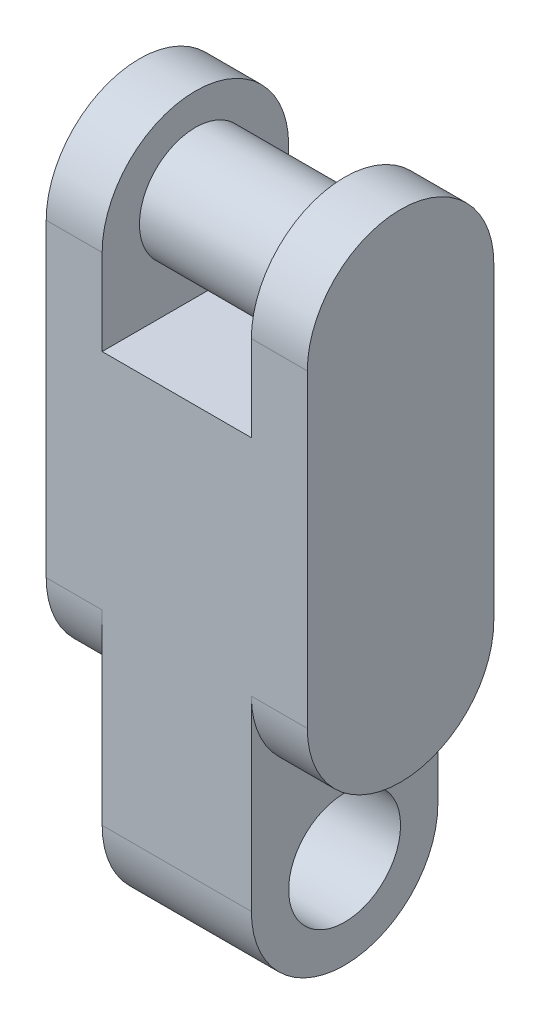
SolidWorks part; units mm, degrees
ref_plane "Front Plane" through (0, 0, 0) normal (0, 0, 1) x (1, 0, 0)
ref_plane "Top Plane" through (0, 0, 0) normal (0, 1, 0) x (1, 0, 0)
ref_plane "Right Plane" through (0, 0, 0) normal (1, 0, 0) x (0, 0, -1)
sketch "Sketch1" plane through (0, 0, 0) normal (0, 0, 1) x (1, 0, 0)
  line L1 (-58.945, 37.0453) -> (-58.945, 10.4453)
  line L2 (-58.945, 10.4453) -> (-55.945, 10.4453)
  line L3 (-44.945, 10.4453) -> (-44.945, 37.0453)
  line L5 (-47.945, 10.4453) -> (-47.945, 0.4453)
  line L6 (-55.945, 37.0453) -> (-55.945, 27.4465)
  line L7 (-55.945, 27.4465) -> (-47.945, 27.4465)
  line L8 (-47.945, 27.4465) -> (-47.945, 37.0453)
  line L9 (-58.945, 37.0453) -> (-55.945, 37.0453)
  line L10 (-47.945, 37.0453) -> (-44.945, 37.0453)
  line L11 (-47.945, 0.4453) -> (-55.945, 0.4453)
  line L12 (-55.945, 0.4453) -> (-55.945, 10.4453)
  line L13 (-47.945, 10.4453) -> (-44.945, 10.4453)
extrude "Boss-Extrude1" add sketch "Sketch1" along normal blind 10
sketch "Sketch2" plane through (-47.945, 0, 0) normal (-1, 0, 0) x (0, 0, 1)
  circle A0 centre (5, 32.354) radius 3
extrude "Boss-Extrude2" add sketch "Sketch2" along normal blind 8
sketch "Sketch3" plane through (-47.945, 0, 0) normal (1, 0, 0) x (0, 0, -1)
  line L0 (-10, 5.4453) -> (-10, 0.4453)
  line L1 (-10, 0.4453) -> (-10, 10.4453) construction
  line L2 (-10, 0.4453) -> (0, 0.4453)
  line L3 (0, 0.4453) -> (0, 5.4453)
  circle A0 centre (-5, 5.4453) radius 3
  circle A1 centre (-5, 5.4453) radius 5
extrude "Cut-Extrude1" cut sketch "Sketch3" against normal blind 8 contours A0 | A1 M3 M4 | A1 L2 M1
sketch "Sketch4" plane through (-58.945, 0, 0) normal (-1, 0, 0) x (0, 0, 1)
  line L1 (0, 32.0453) -> (0, 37.0453)
  line L2 (0, 37.0453) -> (10, 37.0453)
  line L3 (10, 37.0453) -> (10, 32.0453)
  circle A1 centre (5, 32.0453) radius 5
extrude "Cut-Extrude2" cut sketch "Sketch4" against normal blind 21 contours A1 L2 M1 | A1 M3 M4
sketch "Sketch5" plane through (-58.945, 0, 0) normal (-1, 0, 0) x (0, 0, 1)
  line L1 (0, 15.4453) -> (0, 10.4453)
  line L2 (0, 10.4453) -> (10, 10.4453)
  line L3 (10, 10.4453) -> (10, 15.4453)
  circle A1 centre (5, 15.4453) radius 5
extrude "Cut-Extrude3" cut sketch "Sketch5" against normal blind 3 contours A1 M3 M4 | A1 L2 M1
sketch "Sketch6" plane through (-44.945, 0, 0) normal (1, 0, 0) x (0, 0, -1)
  line L0 (-10, 15.4453) -> (-10, 10.4453)
  line L1 (0, 15.4453) -> (0, 10.4453)
  line L2 (0, 10.4453) -> (-10, 10.4453)
  circle A1 centre (-5, 15.4453) radius 5
extrude "Cut-Extrude4" cut sketch "Sketch6" against normal blind 3 contours A1 M2 M3 | A1 L2 M4
